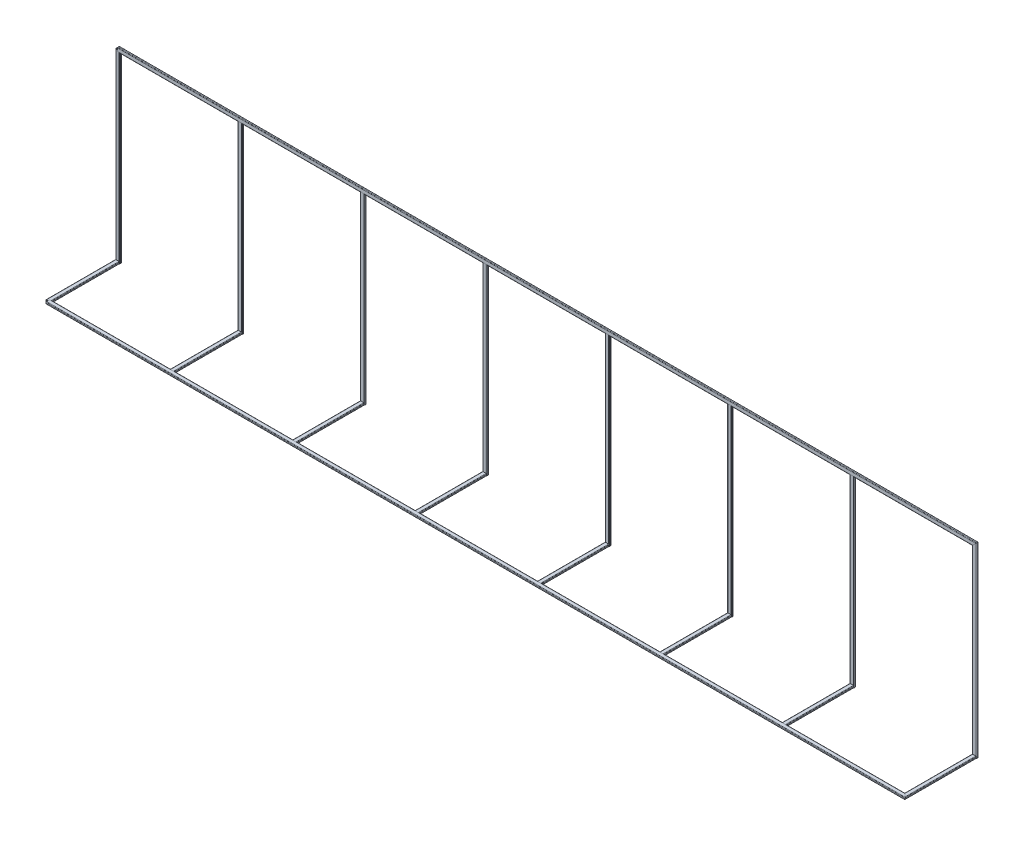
SolidWorks part; units mm, degrees
ref_plane "Front" through (0, 0, 0) normal (0, 0, 1) x (1, 0, 0)
ref_plane "Top" through (0, 0, 0) normal (0, 1, 0) x (1, 0, 0)
ref_plane "Right" through (0, 0, 0) normal (1, 0, 0) x (0, 0, -1)
sketch "Sketch4" plane through (0, 0, 0) normal (0, 0, 1) x (1, 0, 0)
  line L0 (0, 0) -> (-33528, 0)
  line L1 (-33528, 0) -> (-33528, -4572)
  line L2 (-30480, 0) -> (-30480, -4572)
  line L3 (-27432, 0) -> (-27432, -4572)
  line L4 (-24384, 0) -> (-24384, -4572)
  line L5 (-21336, 0) -> (-21336, -4572)
  line L6 (-18288, 0) -> (-18288, -4572)
  line L7 (-15240, 0) -> (-15240, -4572)
  line L8 (-12192, 0) -> (-12192, -4572)
  line L9 (-9144, 0) -> (-9144, -4572)
  line L10 (-6096, 0) -> (-6096, -4572)
  line L11 (-3048, 0) -> (-3048, -4572)
  line L12 (0, 0) -> (0, -4572)
  dimension "D1" = 33528
  dimension "D2" = 4572
  dimension "D3" = 12
ref_plane "Plane2" through (0, -4572, 0) normal (0, 1, 0) x (1, 0, 0)
sketch "Sketch5" plane through (0, -4572, 0) normal (0, 1, 0) x (1, 0, 0)
  line L3 (0, 0) -> (0, -1755.0384)
  line L4 (-3048, 0) -> (-3048, -1755.0384)
  line L5 (-6096, 0) -> (-6096, -1755.0384)
  line L6 (-9144, 0) -> (-9144, -1755.0384)
  line L7 (-12192, 0) -> (-12192, -1755.0384)
  line L8 (-15240, 0) -> (-15240, -1755.0384)
  line L9 (-18288, 0) -> (-18288, -1755.0384)
  line L10 (-21336, 0) -> (-21336, -1755.0384)
  line L11 (-24384, 0) -> (-24384, -1755.0384)
  line L12 (-27432, 0) -> (-27432, -1755.0384)
  line L13 (-30480, 0) -> (-30480, -1755.0384)
  line L14 (-33528, 0) -> (-33528, -1755.0384)
  dimension "D1" = 1755.0384
  dimension "D2" = 12
ref_plane "Plane3" through (0, 0, 0) normal (0, 0.3584, 0.9336) x (1, 0, 0)
sketch "Sketch6" plane through (0, 0, 0) normal (0, 0.3584, 0.9336) x (1, 0, 0)
  line L0 (0, 0) -> (0, -4897.2792)
  line L1 (-3048, 0) -> (-3048, -4897.2792)
  line L2 (-6096, 0) -> (-6096, -4897.2792)
  line L3 (-9144, 0) -> (-9144, -4897.2792)
  line L4 (-12192, 0) -> (-12192, -4897.2792)
  line L5 (-15240, 0) -> (-15240, -4897.2792)
  line L6 (-18288, 0) -> (-18288, -4897.2792)
  line L7 (-21336, 0) -> (-21336, -4897.2792)
  line L8 (-24384, 0) -> (-24384, -4897.2792)
  line L9 (-27432, 0) -> (-27432, -4897.2792)
  line L10 (-30480, 0) -> (-30480, -4897.2792)
  line L11 (-33528, 0) -> (-33528, -4897.2792)
  line L12 (-33528, -4897.2792) -> (0, -4897.2792)
  line L13 (-33528, -2448.6396) -> (0, -2448.6396)
  line L14 (-1524, 0) -> (-1524, -4897.2792)
  line L15 (-3048, 0) -> (-3048, -4897.2792)
  line L16 (-4572, 0) -> (-4572, -4897.2792)
  line L17 (-6096, 0) -> (-6096, -4897.2792)
  line L18 (-7620, 0) -> (-7620, -4897.2792)
  line L19 (-9144, 0) -> (-9144, -4897.2792)
  line L20 (-10668, 0) -> (-10668, -4897.2792)
  line L21 (-12192, 0) -> (-12192, -4897.2792)
  line L22 (-13716, 0) -> (-13716, -4897.2792)
  line L23 (-15240, 0) -> (-15240, -4897.2792)
  line L24 (-16764, 0) -> (-16764, -4897.2792)
  line L25 (-18288, 0) -> (-18288, -4897.2792)
  line L26 (-19812, 0) -> (-19812, -4897.2792)
  line L27 (-21336, 0) -> (-21336, -4897.2792)
  line L28 (-22860, 0) -> (-22860, -4897.2792)
  line L29 (-24384, 0) -> (-24384, -4897.2792)
  line L30 (-25908, 0) -> (-25908, -4897.2792)
  line L31 (-27432, 0) -> (-27432, -4897.2792)
  line L32 (-28956, 0) -> (-28956, -4897.2792)
  line L33 (-30480, 0) -> (-30480, -4897.2792)
  line L34 (-32004, 0) -> (-32004, -4897.2792)
  line L35 (-33528, 0) -> (-33528, -4897.2792)
  line L37 (0, 0) -> (-1524, 0)
  line L38 (0, 0) -> (0, -2448.6396)
  line L39 (0, -2448.6396) -> (-1524, -2448.6396)
  line L40 (-1524, 0) -> (-1524, -2448.6396)
  dimension "D1" = 12
  dimension "D2" = 23
other "Rectangular tube 4 X 2 X 0.25(1)"
ref_plane "Plane4" through (0, -4572, 1755.0384) normal (-1, 0, 0) x (0, 1, 0)
sketch "Sketch1" plane through (0, -4572, 1755.0384) normal (-1, 0, 0) x (0, 1, 0)
  line L0 (-12.7, -44.45) -> (12.7, -44.45)
  line L1 (-19.05, -38.1) -> (-19.05, 38.1)
  line L2 (12.7, 44.45) -> (-12.7, 44.45)
  line L3 (19.05, 38.1) -> (19.05, -38.1)
  line L4 (-12.7, -50.8) -> (12.7, -50.8)
  line L5 (-25.4, -38.1) -> (-25.4, 38.1)
  line L6 (12.7, 50.8) -> (-12.7, 50.8)
  line L7 (25.4, 38.1) -> (25.4, -38.1)
  line L8 (0, 0) -> (25.4, 0) construction
  line L9 (0, 0) -> (0, 50.8) construction
  arc A0 (25.4, 38.1) -> (12.7, 50.8) centre (12.7, 38.1) ccw
  arc A1 (12.7, -50.8) -> (25.4, -38.1) centre (12.7, -38.1) ccw
  arc A2 (-25.4, -38.1) -> (-12.7, -50.8) centre (-12.7, -38.1) ccw
  arc A3 (-12.7, 50.8) -> (-25.4, 38.1) centre (-12.7, 38.1) ccw
  arc A4 (-12.7, 44.45) -> (-19.05, 38.1) centre (-12.7, 38.1) ccw
  arc A5 (19.05, 38.1) -> (12.7, 44.45) centre (12.7, 38.1) ccw
  arc A6 (12.7, -44.45) -> (19.05, -38.1) centre (12.7, -38.1) ccw
  arc A7 (-19.05, -38.1) -> (-12.7, -44.45) centre (-12.7, -38.1) ccw
  point P3 (0, -50.8)
  point P4 (-25.4, 0)
  point P5 (0, 0)
  point P6 (25.4, -50.8)
  point P7 (-25.4, -50.8)
  point P8 (-25.4, 50.8)
  point P33 (0, 0)
  point P35 (25.4, 50.8)
  point P36 (25.4, 0)
  point P37 (0, 50.8)
  dimension "D1" = 12.7
  dimension "Thickness" = 6.35
  dimension "V_leg" = 101.6
  dimension "H_leg" = 50.8
other "Rectangular tube 4 X 2 X 0.25(2)"
ref_plane "Plane5" through (-33528, -4572, 0) normal (0, 0, 1) x (0, 1, 0)
sketch "Sketch11" plane through (-33528, -4572, 0) normal (0, 0, 1) x (0, 1, 0)
  line L0 (-12.7, -44.45) -> (12.7, -44.45)
  line L1 (-19.05, -38.1) -> (-19.05, 38.1)
  line L2 (12.7, 44.45) -> (-12.7, 44.45)
  line L3 (19.05, 38.1) -> (19.05, -38.1)
  line L4 (-12.7, -50.8) -> (12.7, -50.8)
  line L5 (-25.4, -38.1) -> (-25.4, 38.1)
  line L6 (12.7, 50.8) -> (-12.7, 50.8)
  line L7 (25.4, 38.1) -> (25.4, -38.1)
  line L8 (0, 0) -> (25.4, 0) construction
  line L9 (0, 0) -> (0, 50.8) construction
  arc A0 (25.4, 38.1) -> (12.7, 50.8) centre (12.7, 38.1) ccw
  arc A1 (12.7, -50.8) -> (25.4, -38.1) centre (12.7, -38.1) ccw
  arc A2 (-25.4, -38.1) -> (-12.7, -50.8) centre (-12.7, -38.1) ccw
  arc A3 (-12.7, 50.8) -> (-25.4, 38.1) centre (-12.7, 38.1) ccw
  arc A4 (-12.7, 44.45) -> (-19.05, 38.1) centre (-12.7, 38.1) ccw
  arc A5 (19.05, 38.1) -> (12.7, 44.45) centre (12.7, 38.1) ccw
  arc A6 (12.7, -44.45) -> (19.05, -38.1) centre (12.7, -38.1) ccw
  arc A7 (-19.05, -38.1) -> (-12.7, -44.45) centre (-12.7, -38.1) ccw
  point P3 (0, -50.8)
  point P4 (-25.4, 0)
  point P5 (0, 0)
  point P6 (25.4, -50.8)
  point P7 (-25.4, -50.8)
  point P8 (-25.4, 50.8)
  point P33 (0, 0)
  point P35 (25.4, 50.8)
  point P36 (25.4, 0)
  point P37 (0, 50.8)
  dimension "D1" = 12.7
  dimension "Thickness" = 6.35
  dimension "V_leg" = 101.6
  dimension "H_leg" = 50.8
other "Rectangular tube 4 X 2 X 0.25(3)"
ref_plane "Plane6" through (-30480, -4572, 0) normal (0, 0, 1) x (0, 1, 0)
sketch "Sketch12" plane through (-30480, -4572, 0) normal (0, 0, 1) x (0, 1, 0)
  line L0 (-12.7, -44.45) -> (12.7, -44.45)
  line L1 (-19.05, -38.1) -> (-19.05, 38.1)
  line L2 (12.7, 44.45) -> (-12.7, 44.45)
  line L3 (19.05, 38.1) -> (19.05, -38.1)
  line L4 (-12.7, -50.8) -> (12.7, -50.8)
  line L5 (-25.4, -38.1) -> (-25.4, 38.1)
  line L6 (12.7, 50.8) -> (-12.7, 50.8)
  line L7 (25.4, 38.1) -> (25.4, -38.1)
  line L8 (0, 0) -> (25.4, 0) construction
  line L9 (0, 0) -> (0, 50.8) construction
  arc A0 (25.4, 38.1) -> (12.7, 50.8) centre (12.7, 38.1) ccw
  arc A1 (12.7, -50.8) -> (25.4, -38.1) centre (12.7, -38.1) ccw
  arc A2 (-25.4, -38.1) -> (-12.7, -50.8) centre (-12.7, -38.1) ccw
  arc A3 (-12.7, 50.8) -> (-25.4, 38.1) centre (-12.7, 38.1) ccw
  arc A4 (-12.7, 44.45) -> (-19.05, 38.1) centre (-12.7, 38.1) ccw
  arc A5 (19.05, 38.1) -> (12.7, 44.45) centre (12.7, 38.1) ccw
  arc A6 (12.7, -44.45) -> (19.05, -38.1) centre (12.7, -38.1) ccw
  arc A7 (-19.05, -38.1) -> (-12.7, -44.45) centre (-12.7, -38.1) ccw
  point P3 (0, -50.8)
  point P4 (-25.4, 0)
  point P5 (0, 0)
  point P6 (25.4, -50.8)
  point P7 (-25.4, -50.8)
  point P8 (-25.4, 50.8)
  point P33 (0, 0)
  point P35 (25.4, 50.8)
  point P36 (25.4, 0)
  point P37 (0, 50.8)
  dimension "D1" = 12.7
  dimension "Thickness" = 6.35
  dimension "V_leg" = 101.6
  dimension "H_leg" = 50.8
other "Rectangular tube 4 X 2 X 0.25(4)"
ref_plane "Plane7" through (-27432, -4572, 0) normal (0, 0, 1) x (0, 1, 0)
sketch "Sketch13" plane through (-27432, -4572, 0) normal (0, 0, 1) x (0, 1, 0)
  line L0 (-12.7, -44.45) -> (12.7, -44.45)
  line L1 (-19.05, -38.1) -> (-19.05, 38.1)
  line L2 (12.7, 44.45) -> (-12.7, 44.45)
  line L3 (19.05, 38.1) -> (19.05, -38.1)
  line L4 (-12.7, -50.8) -> (12.7, -50.8)
  line L5 (-25.4, -38.1) -> (-25.4, 38.1)
  line L6 (12.7, 50.8) -> (-12.7, 50.8)
  line L7 (25.4, 38.1) -> (25.4, -38.1)
  line L8 (0, 0) -> (25.4, 0) construction
  line L9 (0, 0) -> (0, 50.8) construction
  arc A0 (25.4, 38.1) -> (12.7, 50.8) centre (12.7, 38.1) ccw
  arc A1 (12.7, -50.8) -> (25.4, -38.1) centre (12.7, -38.1) ccw
  arc A2 (-25.4, -38.1) -> (-12.7, -50.8) centre (-12.7, -38.1) ccw
  arc A3 (-12.7, 50.8) -> (-25.4, 38.1) centre (-12.7, 38.1) ccw
  arc A4 (-12.7, 44.45) -> (-19.05, 38.1) centre (-12.7, 38.1) ccw
  arc A5 (19.05, 38.1) -> (12.7, 44.45) centre (12.7, 38.1) ccw
  arc A6 (12.7, -44.45) -> (19.05, -38.1) centre (12.7, -38.1) ccw
  arc A7 (-19.05, -38.1) -> (-12.7, -44.45) centre (-12.7, -38.1) ccw
  point P3 (0, -50.8)
  point P4 (-25.4, 0)
  point P5 (0, 0)
  point P6 (25.4, -50.8)
  point P7 (-25.4, -50.8)
  point P8 (-25.4, 50.8)
  point P33 (0, 0)
  point P35 (25.4, 50.8)
  point P36 (25.4, 0)
  point P37 (0, 50.8)
  dimension "D1" = 12.7
  dimension "Thickness" = 6.35
  dimension "V_leg" = 101.6
  dimension "H_leg" = 50.8
other "Rectangular tube 4 X 2 X 0.25(5)"
ref_plane "Plane8" through (-24384, -4572, 0) normal (0, 0, 1) x (0, 1, 0)
sketch "Sketch14" plane through (-24384, -4572, 0) normal (0, 0, 1) x (0, 1, 0)
  line L0 (-12.7, -44.45) -> (12.7, -44.45)
  line L1 (-19.05, -38.1) -> (-19.05, 38.1)
  line L2 (12.7, 44.45) -> (-12.7, 44.45)
  line L3 (19.05, 38.1) -> (19.05, -38.1)
  line L4 (-12.7, -50.8) -> (12.7, -50.8)
  line L5 (-25.4, -38.1) -> (-25.4, 38.1)
  line L6 (12.7, 50.8) -> (-12.7, 50.8)
  line L7 (25.4, 38.1) -> (25.4, -38.1)
  line L8 (0, 0) -> (25.4, 0) construction
  line L9 (0, 0) -> (0, 50.8) construction
  arc A0 (25.4, 38.1) -> (12.7, 50.8) centre (12.7, 38.1) ccw
  arc A1 (12.7, -50.8) -> (25.4, -38.1) centre (12.7, -38.1) ccw
  arc A2 (-25.4, -38.1) -> (-12.7, -50.8) centre (-12.7, -38.1) ccw
  arc A3 (-12.7, 50.8) -> (-25.4, 38.1) centre (-12.7, 38.1) ccw
  arc A4 (-12.7, 44.45) -> (-19.05, 38.1) centre (-12.7, 38.1) ccw
  arc A5 (19.05, 38.1) -> (12.7, 44.45) centre (12.7, 38.1) ccw
  arc A6 (12.7, -44.45) -> (19.05, -38.1) centre (12.7, -38.1) ccw
  arc A7 (-19.05, -38.1) -> (-12.7, -44.45) centre (-12.7, -38.1) ccw
  point P3 (0, -50.8)
  point P4 (-25.4, 0)
  point P5 (0, 0)
  point P6 (25.4, -50.8)
  point P7 (-25.4, -50.8)
  point P8 (-25.4, 50.8)
  point P33 (0, 0)
  point P35 (25.4, 50.8)
  point P36 (25.4, 0)
  point P37 (0, 50.8)
  dimension "D1" = 12.7
  dimension "Thickness" = 6.35
  dimension "V_leg" = 101.6
  dimension "H_leg" = 50.8
other "Rectangular tube 4 X 2 X 0.25(6)"
ref_plane "Plane9" through (-21336, -4572, 0) normal (0, 0, 1) x (0, 1, 0)
sketch "Sketch15" plane through (-21336, -4572, 0) normal (0, 0, 1) x (0, 1, 0)
  line L0 (-12.7, -44.45) -> (12.7, -44.45)
  line L1 (-19.05, -38.1) -> (-19.05, 38.1)
  line L2 (12.7, 44.45) -> (-12.7, 44.45)
  line L3 (19.05, 38.1) -> (19.05, -38.1)
  line L4 (-12.7, -50.8) -> (12.7, -50.8)
  line L5 (-25.4, -38.1) -> (-25.4, 38.1)
  line L6 (12.7, 50.8) -> (-12.7, 50.8)
  line L7 (25.4, 38.1) -> (25.4, -38.1)
  line L8 (0, 0) -> (25.4, 0) construction
  line L9 (0, 0) -> (0, 50.8) construction
  arc A0 (25.4, 38.1) -> (12.7, 50.8) centre (12.7, 38.1) ccw
  arc A1 (12.7, -50.8) -> (25.4, -38.1) centre (12.7, -38.1) ccw
  arc A2 (-25.4, -38.1) -> (-12.7, -50.8) centre (-12.7, -38.1) ccw
  arc A3 (-12.7, 50.8) -> (-25.4, 38.1) centre (-12.7, 38.1) ccw
  arc A4 (-12.7, 44.45) -> (-19.05, 38.1) centre (-12.7, 38.1) ccw
  arc A5 (19.05, 38.1) -> (12.7, 44.45) centre (12.7, 38.1) ccw
  arc A6 (12.7, -44.45) -> (19.05, -38.1) centre (12.7, -38.1) ccw
  arc A7 (-19.05, -38.1) -> (-12.7, -44.45) centre (-12.7, -38.1) ccw
  point P3 (0, -50.8)
  point P4 (-25.4, 0)
  point P5 (0, 0)
  point P6 (25.4, -50.8)
  point P7 (-25.4, -50.8)
  point P8 (-25.4, 50.8)
  point P33 (0, 0)
  point P35 (25.4, 50.8)
  point P36 (25.4, 0)
  point P37 (0, 50.8)
  dimension "D1" = 12.7
  dimension "Thickness" = 6.35
  dimension "V_leg" = 101.6
  dimension "H_leg" = 50.8
other "Rectangular tube 4 X 2 X 0.25(7)"
ref_plane "Plane10" through (-18288, -4572, 0) normal (0, 0, 1) x (0, 1, 0)
sketch "Sketch16" plane through (-18288, -4572, 0) normal (0, 0, 1) x (0, 1, 0)
  line L0 (-12.7, -44.45) -> (12.7, -44.45)
  line L1 (-19.05, -38.1) -> (-19.05, 38.1)
  line L2 (12.7, 44.45) -> (-12.7, 44.45)
  line L3 (19.05, 38.1) -> (19.05, -38.1)
  line L4 (-12.7, -50.8) -> (12.7, -50.8)
  line L5 (-25.4, -38.1) -> (-25.4, 38.1)
  line L6 (12.7, 50.8) -> (-12.7, 50.8)
  line L7 (25.4, 38.1) -> (25.4, -38.1)
  line L8 (0, 0) -> (25.4, 0) construction
  line L9 (0, 0) -> (0, 50.8) construction
  arc A0 (25.4, 38.1) -> (12.7, 50.8) centre (12.7, 38.1) ccw
  arc A1 (12.7, -50.8) -> (25.4, -38.1) centre (12.7, -38.1) ccw
  arc A2 (-25.4, -38.1) -> (-12.7, -50.8) centre (-12.7, -38.1) ccw
  arc A3 (-12.7, 50.8) -> (-25.4, 38.1) centre (-12.7, 38.1) ccw
  arc A4 (-12.7, 44.45) -> (-19.05, 38.1) centre (-12.7, 38.1) ccw
  arc A5 (19.05, 38.1) -> (12.7, 44.45) centre (12.7, 38.1) ccw
  arc A6 (12.7, -44.45) -> (19.05, -38.1) centre (12.7, -38.1) ccw
  arc A7 (-19.05, -38.1) -> (-12.7, -44.45) centre (-12.7, -38.1) ccw
  point P3 (0, -50.8)
  point P4 (-25.4, 0)
  point P5 (0, 0)
  point P6 (25.4, -50.8)
  point P7 (-25.4, -50.8)
  point P8 (-25.4, 50.8)
  point P33 (0, 0)
  point P35 (25.4, 50.8)
  point P36 (25.4, 0)
  point P37 (0, 50.8)
  dimension "D1" = 12.7
  dimension "Thickness" = 6.35
  dimension "V_leg" = 101.6
  dimension "H_leg" = 50.8
other "Rectangular tube 4 X 2 X 0.25(8)"
ref_plane "Plane11" through (-15240, -4572, 0) normal (0, 0, 1) x (0, 1, 0)
sketch "Sketch17" plane through (-15240, -4572, 0) normal (0, 0, 1) x (0, 1, 0)
  line L0 (-12.7, -44.45) -> (12.7, -44.45)
  line L1 (-19.05, -38.1) -> (-19.05, 38.1)
  line L2 (12.7, 44.45) -> (-12.7, 44.45)
  line L3 (19.05, 38.1) -> (19.05, -38.1)
  line L4 (-12.7, -50.8) -> (12.7, -50.8)
  line L5 (-25.4, -38.1) -> (-25.4, 38.1)
  line L6 (12.7, 50.8) -> (-12.7, 50.8)
  line L7 (25.4, 38.1) -> (25.4, -38.1)
  line L8 (0, 0) -> (25.4, 0) construction
  line L9 (0, 0) -> (0, 50.8) construction
  arc A0 (25.4, 38.1) -> (12.7, 50.8) centre (12.7, 38.1) ccw
  arc A1 (12.7, -50.8) -> (25.4, -38.1) centre (12.7, -38.1) ccw
  arc A2 (-25.4, -38.1) -> (-12.7, -50.8) centre (-12.7, -38.1) ccw
  arc A3 (-12.7, 50.8) -> (-25.4, 38.1) centre (-12.7, 38.1) ccw
  arc A4 (-12.7, 44.45) -> (-19.05, 38.1) centre (-12.7, 38.1) ccw
  arc A5 (19.05, 38.1) -> (12.7, 44.45) centre (12.7, 38.1) ccw
  arc A6 (12.7, -44.45) -> (19.05, -38.1) centre (12.7, -38.1) ccw
  arc A7 (-19.05, -38.1) -> (-12.7, -44.45) centre (-12.7, -38.1) ccw
  point P3 (0, -50.8)
  point P4 (-25.4, 0)
  point P5 (0, 0)
  point P6 (25.4, -50.8)
  point P7 (-25.4, -50.8)
  point P8 (-25.4, 50.8)
  point P33 (0, 0)
  point P35 (25.4, 50.8)
  point P36 (25.4, 0)
  point P37 (0, 50.8)
  dimension "D1" = 12.7
  dimension "Thickness" = 6.35
  dimension "V_leg" = 101.6
  dimension "H_leg" = 50.8
other "Rectangular tube 4 X 2 X 0.25(9)"
ref_plane "Plane12" through (-12192, 0, 0) normal (0, -1, 0) x (0, 0, 1)
sketch "Sketch18" plane through (-12192, 0, 0) normal (0, -1, 0) x (0, 0, 1)
  line L0 (-12.7, -44.45) -> (12.7, -44.45)
  line L1 (-19.05, -38.1) -> (-19.05, 38.1)
  line L2 (12.7, 44.45) -> (-12.7, 44.45)
  line L3 (19.05, 38.1) -> (19.05, -38.1)
  line L4 (-12.7, -50.8) -> (12.7, -50.8)
  line L5 (-25.4, -38.1) -> (-25.4, 38.1)
  line L6 (12.7, 50.8) -> (-12.7, 50.8)
  line L7 (25.4, 38.1) -> (25.4, -38.1)
  line L8 (0, 0) -> (25.4, 0) construction
  line L9 (0, 0) -> (0, 50.8) construction
  arc A0 (25.4, 38.1) -> (12.7, 50.8) centre (12.7, 38.1) ccw
  arc A1 (12.7, -50.8) -> (25.4, -38.1) centre (12.7, -38.1) ccw
  arc A2 (-25.4, -38.1) -> (-12.7, -50.8) centre (-12.7, -38.1) ccw
  arc A3 (-12.7, 50.8) -> (-25.4, 38.1) centre (-12.7, 38.1) ccw
  arc A4 (-12.7, 44.45) -> (-19.05, 38.1) centre (-12.7, 38.1) ccw
  arc A5 (19.05, 38.1) -> (12.7, 44.45) centre (12.7, 38.1) ccw
  arc A6 (12.7, -44.45) -> (19.05, -38.1) centre (12.7, -38.1) ccw
  arc A7 (-19.05, -38.1) -> (-12.7, -44.45) centre (-12.7, -38.1) ccw
  point P3 (0, -50.8)
  point P4 (-25.4, 0)
  point P5 (0, 0)
  point P6 (25.4, -50.8)
  point P7 (-25.4, -50.8)
  point P8 (-25.4, 50.8)
  point P33 (0, 0)
  point P35 (25.4, 50.8)
  point P36 (25.4, 0)
  point P37 (0, 50.8)
  dimension "D1" = 12.7
  dimension "Thickness" = 6.35
  dimension "V_leg" = 101.6
  dimension "H_leg" = 50.8
other "Trim/Extend2"
other "Rectangular tube 4 X 2 X 0.25(29)"
ref_plane "Plane18" through (0, 0, 0) normal (-1, 0, 0) x (0, 0, 1)
sketch "Sketch118" plane through (0, 0, 0) normal (-1, 0, 0) x (0, 0, 1)
  line L0 (-12.7, -44.45) -> (12.7, -44.45)
  line L1 (-19.05, -38.1) -> (-19.05, 38.1)
  line L2 (12.7, 44.45) -> (-12.7, 44.45)
  line L3 (19.05, 38.1) -> (19.05, -38.1)
  line L4 (-12.7, -50.8) -> (12.7, -50.8)
  line L5 (-25.4, -38.1) -> (-25.4, 38.1)
  line L6 (12.7, 50.8) -> (-12.7, 50.8)
  line L7 (25.4, 38.1) -> (25.4, -38.1)
  line L8 (0, 0) -> (25.4, 0) construction
  line L9 (0, 0) -> (0, 50.8) construction
  arc A0 (25.4, 38.1) -> (12.7, 50.8) centre (12.7, 38.1) ccw
  arc A1 (12.7, -50.8) -> (25.4, -38.1) centre (12.7, -38.1) ccw
  arc A2 (-25.4, -38.1) -> (-12.7, -50.8) centre (-12.7, -38.1) ccw
  arc A3 (-12.7, 50.8) -> (-25.4, 38.1) centre (-12.7, 38.1) ccw
  arc A4 (-12.7, 44.45) -> (-19.05, 38.1) centre (-12.7, 38.1) ccw
  arc A5 (19.05, 38.1) -> (12.7, 44.45) centre (12.7, 38.1) ccw
  arc A6 (12.7, -44.45) -> (19.05, -38.1) centre (12.7, -38.1) ccw
  arc A7 (-19.05, -38.1) -> (-12.7, -44.45) centre (-12.7, -38.1) ccw
  point P3 (0, -50.8)
  point P4 (-25.4, 0)
  point P5 (0, 0)
  point P6 (25.4, -50.8)
  point P7 (-25.4, -50.8)
  point P8 (-25.4, 50.8)
  point P33 (0, 0)
  point P35 (25.4, 50.8)
  point P36 (25.4, 0)
  point P37 (0, 50.8)
  dimension "D1" = 12.7
  dimension "Thickness" = 6.35
  dimension "V_leg" = 101.6
  dimension "H_leg" = 50.8
other "Trim/Extend4"
